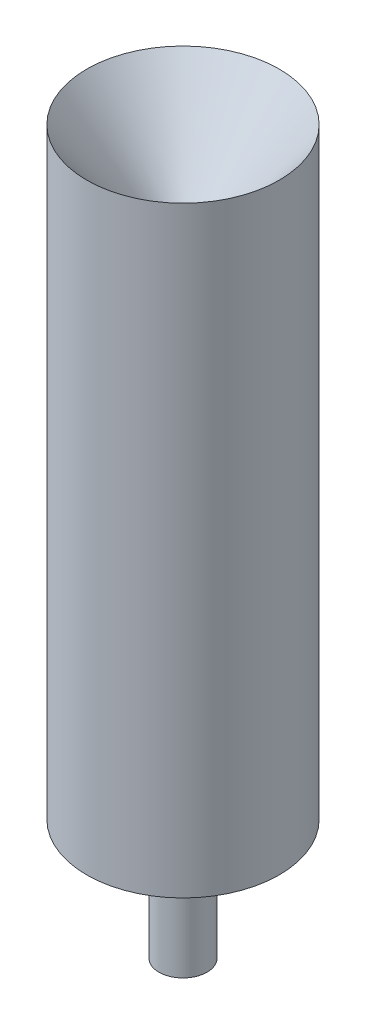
SolidWorks part; units mm, degrees
ref_plane "Front Plane" through (0, 0, 0) normal (0, 0, 1) x (1, 0, 0)
ref_plane "Top Plane" through (0, 0, 0) normal (0, 1, 0) x (1, 0, 0)
ref_plane "Right Plane" through (0, 0, 0) normal (1, 0, 0) x (0, 0, -1)
sketch "Sketch1" plane through (0, 0, 0) normal (0, 0, 1) x (1, 0, 0)
  line L0 (0, 0) -> (2, 0)
  line L1 (2, 0) -> (2, 10)
  line L2 (2, 10) -> (8, 10)
  line L3 (8, 10) -> (8, 60)
  line L4 (8, 60) -> (0, 50)
  line L5 (0, 50) -> (0, 0) construction
  line L6 (0, 0) -> (0, 50)
  dimension "D1" = 2
  dimension "D2" = 6
  dimension "D3" = 50
  dimension "D4" = 10
  dimension "D5" = 50
revolve "Revolve1" add sketch "Sketch1" angle 360 about L5
